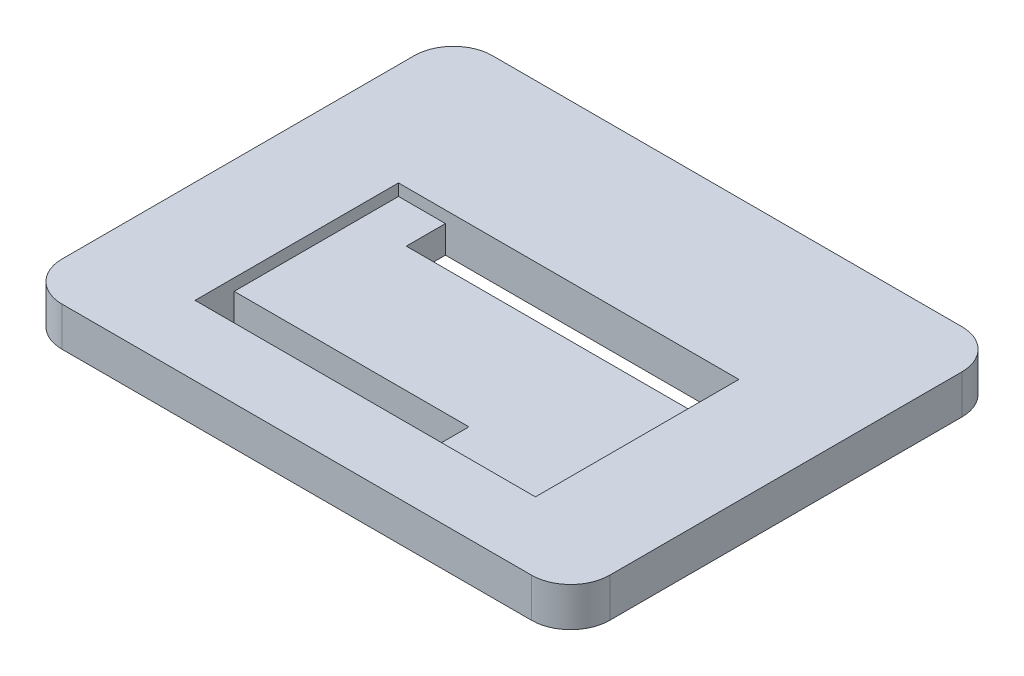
SolidWorks part; units mm, degrees
ref_plane "Plan de face" through (0, 0, 0) normal (0, 0, 1) x (1, 0, 0)
ref_plane "Plan de dessus" through (0, 0, 0) normal (0, 1, 0) x (1, 0, 0)
ref_plane "Plan de droite" through (0, 0, 0) normal (1, 0, 0) x (0, 0, -1)
sketch "Esquisse1" plane through (0, 0, 0) normal (0, 1, 0) x (1, 0, 0)
  line L1 (-71.0763, 36.9349) -> (68.9037, 36.9349)
  line L2 (-71.0763, 36.9349) -> (-71.0763, -73.0651)
  line L3 (-71.0763, -73.0651) -> (68.9037, -73.0651)
  line L4 (68.9037, 36.9349) -> (68.9037, -73.0651)
  dimension "D1" = 139.98
  dimension "D2" = 110
extrude "Boss.-Extru.1" add sketch "Esquisse1" along normal blind 10
fillet "Congé1" radius 10 4 edges at (-71.0763, 5, 73.0651) (-71.0763, 5, -36.9349) (68.9037, 5, -36.9349) (68.9037, 5, 73.0651)
sketch "Esquisse2" plane through (0, 10, 0) normal (0, 1, 0) x (1, 0, 0)
  line L0 (-44.9245, -3.2378) -> (-44.9245, -55.2378)
  line L1 (-71.0763, -63.0651) -> (68.9037, -63.0651) construction
  line L2 (-71.0763, 26.9349) -> (68.9037, 26.9349) construction
  line L3 (-61.0763, 36.9349) -> (-61.0763, -73.0651) construction
  line L4 (58.9037, 36.9349) -> (58.9037, -73.0651) construction
  line L5 (-1.0863, -3.2378) -> (42.0755, -3.2378)
  line L6 (-1.0863, -3.2378) -> (-44.9245, -3.2378)
  line L8 (-1.0863, -63.0651) -> (-1.0863, 26.9349) construction
  line L10 (-44.9245, -55.2378) -> (42.0755, -55.2378)
  line L11 (42.0755, -55.2378) -> (42.0755, -3.2378)
  dimension "D1" = 52
extrude "Enlèv. mat.-Extru.1" cut sketch "Esquisse2" against normal blind 3
sketch "Esquisse3" plane through (0, 7, 0) normal (0, 1, 0) x (1, 0, 0)
  line L1 (-44.9245, -55.2378) -> (15.0755, -55.2378)
  line L2 (-44.9245, -55.2378) -> (-44.9245, -45.2378)
  line L3 (-44.9245, -45.2378) -> (15.0755, -45.2378)
  line L4 (15.0755, -55.2378) -> (15.0755, -45.2378)
  line L5 (42.0755, -3.2378) -> (-32.9245, -3.2378)
  line L6 (42.0755, -3.2378) -> (42.0755, -13.2378)
  line L7 (42.0755, -13.2378) -> (-32.9245, -13.2378)
  line L8 (-32.9245, -3.2378) -> (-32.9245, -13.2378)
  dimension "D1" = 10
  dimension "D2" = 60
  dimension "D3" = 10
  dimension "D4" = 75
extrude "Enlèv. mat.-Extru.2" cut sketch "Esquisse3" against normal blind 17
sketch "Esquisse4" plane through (0, 0, 0) normal (0, -1, 0) x (1, 0, 0)
  circle A1 centre (-64.6119, 66.6007) radius 3.5
  circle A3 centre (-64.6119, -30.4704) radius 3.5
  circle A5 centre (62.4392, 66.6007) radius 3.5
  circle A7 centre (62.4392, -30.4704) radius 3.5
  point P15 (62.4392, -30.4704)
extrude "Enlèv. mat.-Extru.3" cut sketch "Esquisse4" against normal blind 6
